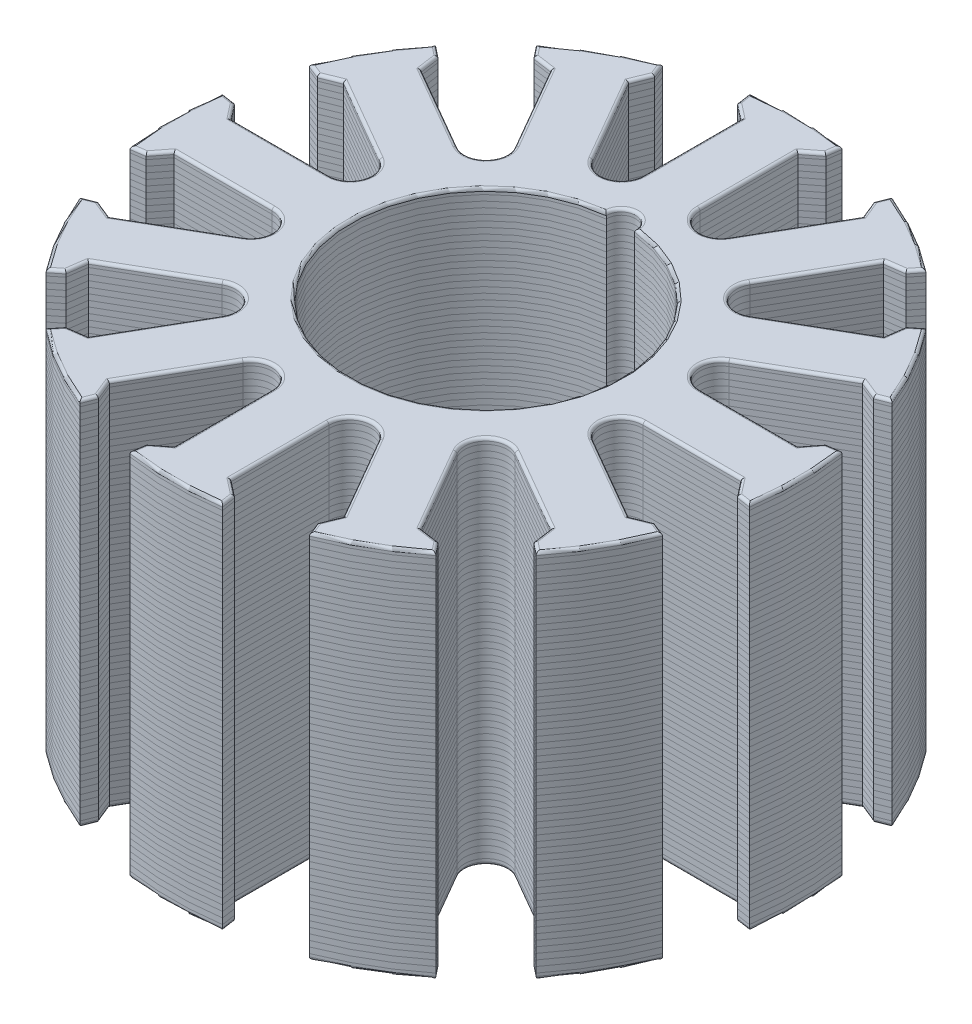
SolidWorks part; units mm, degrees
ref_plane "Plano frontal" through (0, 0, 0) normal (0, 0, 1) x (1, 0, 0)
ref_plane "Plano superior" through (0, 0, 0) normal (0, 1, 0) x (1, 0, 0)
ref_plane "Plano direito" through (0, 0, 0) normal (1, 0, 0) x (0, 0, -1)
sketch "Esboço1" plane through (0, 0, 0) normal (0, 0, 1) x (1, 0, 0)
  line L0 (0, 0) -> (0, 7.5364) construction
  line L2 (4.75, 0) -> (11, 0)
  line L3 (4.75, 0) -> (4.75, 0.2)
  line L4 (4.75, 0.2) -> (11, 0.2)
  line L5 (11, 0) -> (11, 0.2)
  dimension "D1" = 9.5
  dimension "D2" = 22
  dimension "D3" = 0.2
revolve "Revolução1" add sketch "Esboço1" angle 360 about L0
sketch "Esboço2" plane through (0, 0.2, 0) normal (0, 1, 0) x (1, 0, 0)
  line L0 (0, 0) -> (0, 11) construction
  line L1 (0, 0) -> (-1.6259, 10.8792) construction
  line L2 (0, 0) -> (-2.847, 10.6252) construction
  line L3 (-1, 10.9545) -> (-1, 6.5161) construction
  line L4 (0, 0) -> (-4.0315, 10.2346) construction
  line L5 (-4.6112, 9.9868) -> (-2.392, 6.1431) construction
  line L6 (-1, 6.5161) -> (-1, 9.9545)
  line L7 (-1, 9.9545) -> (-1.552, 10.3847)
  line L8 (-1.552, 10.3847) -> (-1.6259, 10.8792)
  line L9 (-2.392, 6.1431) -> (-4.1112, 9.1208)
  line L10 (-4.1112, 9.1208) -> (-3.8483, 9.7694)
  line L11 (-3.8483, 9.7694) -> (-4.0315, 10.2346)
  circle A0 centre (0, 0) radius 11 construction
  circle A1 centre (0, 0) radius 6 construction
  arc A2 (-2.392, 6.1431) -> (-1, 6.5161) centre (-1.746, 6.5161) ccw
  arc A3 (-4.0315, 10.2346) -> (-1.6259, 10.8792) centre (0, 0) cw
  dimension "D4" = 12
  dimension "D1" = 13
  dimension "D2" = 15
  dimension "D3" = 1
  dimension "D5" = 1
  dimension "D6" = 0.5
extrude "Corte-extrusão1" cut sketch "Esboço2" against normal blind 10
pattern_circular "PadrãoCircular1" count 12 over 360 about axis through (0, 0, 0) along (0, 1, 0) of "Corte-extrusão1"
pattern_linear "Padrão linear1" count 65 spacing 0.2 along (0, 1, 0)
sketch "Esboço3" plane through (0, 13, 0) normal (0, 1, 0) x (1, 0, 0)
  circle A0 centre (0, 4.75) radius 0.5
  circle A1 centre (0, 0) radius 4.75 construction
  dimension "D1" = 1
extrude "Corte-extrusão2" cut sketch "Esboço3" against normal through all
fillet "Filete1" radius 0.1 98 edges at (-6.692, 13, 8.413) (-6.1898, 13, 8.1691) (-4.9837, 13, 6.632) (-4.2426, 13, 4.2426) (-6.632, 13, 4.9837) (-8.1691, 13, 6.1898) (-8.413, 13, 6.692) (0, 13, -11) (-1.589, 13, 10.6319) (-1.276, 13, 10.1696) (-1, 13, 8.2353) (-1.5529, 13, 5.7956) (-3.2516, 13, 7.632) (-3.9797, 13, 9.4451) (-3.9399, 13, 10.002) (-10.002, 13, 3.9399) (-9.4451, 13, 3.9797) (-7.632, 13, 3.2516) (-5.7956, 13, 1.5529) (-8.2353, 13, 1) (-10.1696, 13, 1.276) (-10.6319, 13, 1.589) (-10.6319, 13, -1.589) (-10.1696, 13, -1.276) (-8.2353, 13, -1) (-5.7956, 13, -1.5529) (-7.632, 13, -3.2516) (-9.4451, 13, -3.9797) (-10.002, 13, -3.9399) (10.002, 13, -3.9399) (9.4451, 13, -3.9797) (7.632, 13, -3.2516) (5.7956, 13, -1.5529) (8.2353, 13, -1) (10.1696, 13, -1.276) (10.6319, 13, -1.589) (10.6319, 13, 1.589) (10.1696, 13, 1.276) (8.2353, 13, 1) (5.7956, 13, 1.5529) (7.632, 13, 3.2516) (9.4451, 13, 3.9797) (10.002, 13, 3.9399) (-3.9399, 13, -10.002) (-3.9797, 13, -9.4451) (3.9399, 13, 10.002) (3.9797, 13, 9.4451) (3.2516, 13, 7.632) (1.5529, 13, 5.7956) (1, 13, 8.2353) (1.276, 13, 10.1696) (-3.2516, 13, -7.632) (1.589, 13, 10.6319) (-1.5529, 13, -5.7956) (-1, 13, -8.2353) (-1.276, 13, -10.1696) (-1.589, 13, -10.6319) (8.413, 13, 6.692) (8.1691, 13, 6.1898) (6.632, 13, 4.9837) (4.2426, 13, 4.2426) (4.9837, 13, 6.632) (6.1898, 13, 8.1691) (6.692, 13, 8.413) (1.589, 13, -10.6319) (1.276, 13, -10.1696) (1, 13, -8.2353) (1.5529, 13, -5.7956) (3.2516, 13, -7.632) (3.9797, 13, -9.4451) (3.9399, 13, -10.002) (6.692, 13, -8.413) (6.1898, 13, -8.1691) (4.9837, 13, -6.632) (4.2426, 13, -4.2426) (6.632, 13, -4.9837) (8.1691, 13, -6.1898) (8.413, 13, -6.692) (-8.413, 13, -6.692) (-8.1691, 13, -6.1898) (-6.632, 13, -4.9837) (-4.2426, 13, -4.2426) (-4.9837, 13, -6.632) (-6.1898, 13, -8.1691) (-6.692, 13, -8.413) (0, 13, -5.25) (0, 13, 4.75) (5.5, 13, -9.5263) (9.5263, 13, -5.5) (11, 13, 0) (9.5263, 13, 5.5) (5.5, 13, 9.5263) (0, 13, 11) (-5.5, 13, 9.5263) (-9.5263, 13, 5.5) (-11, 13, 0) (-9.5263, 13, -5.5) (-5.5, 13, -9.5263)
fillet "Filete2" radius 0.1 98 edges at (-8.1691, 0, 6.1898) (-6.632, 0, 4.9837) (-4.2426, 0, 4.2426) (-4.9837, 0, 6.632) (-6.1898, 0, 8.1691) (-6.692, 0, 8.413) (-5.5, 0, 9.5263) (-3.9399, 0, 10.002) (-3.9797, 0, 9.4451) (-3.2516, 0, 7.632) (-1.5529, 0, 5.7956) (-1, 0, 8.2353) (-1.276, 0, 10.1696) (-1.589, 0, 10.6319) (0, 0, 11) (1.589, 0, 10.6319) (1.276, 0, 10.1696) (1, 0, 8.2353) (1.5529, 0, 5.7956) (3.2516, 0, 7.632) (3.9797, 0, 9.4451) (3.9399, 0, 10.002) (5.5, 0, 9.5263) (6.692, 0, 8.413) (6.1898, 0, 8.1691) (4.9837, 0, 6.632) (4.2426, 0, 4.2426) (6.632, 0, 4.9837) (8.1691, 0, 6.1898) (8.413, 0, 6.692) (9.5263, 0, 5.5) (10.002, 0, 3.9399) (9.4451, 0, 3.9797) (7.632, 0, 3.2516) (5.7956, 0, 1.5529) (8.2353, 0, 1) (10.1696, 0, 1.276) (10.6319, 0, 1.589) (11, 0, 0) (10.6319, 0, -1.589) (10.1696, 0, -1.276) (8.2353, 0, -1) (5.7956, 0, -1.5529) (7.632, 0, -3.2516) (9.4451, 0, -3.9797) (10.002, 0, -3.9399) (9.5263, 0, -5.5) (8.413, 0, -6.692) (8.1691, 0, -6.1898) (6.632, 0, -4.9837) (4.2426, 0, -4.2426) (4.9837, 0, -6.632) (6.1898, 0, -8.1691) (6.692, 0, -8.413) (5.5, 0, -9.5263) (3.9399, 0, -10.002) (3.9797, 0, -9.4451) (3.2516, 0, -7.632) (1.5529, 0, -5.7956) (1, 0, -8.2353) (1.276, 0, -10.1696) (1.589, 0, -10.6319) (0, 0, -11) (-1.589, 0, -10.6319) (-1.276, 0, -10.1696) (-1, 0, -8.2353) (-1.5529, 0, -5.7956) (-3.2516, 0, -7.632) (-3.9797, 0, -9.4451) (-3.9399, 0, -10.002) (-5.5, 0, -9.5263) (-6.692, 0, -8.413) (-6.1898, 0, -8.1691) (-4.9837, 0, -6.632) (-4.2426, 0, -4.2426) (-6.632, 0, -4.9837) (-8.1691, 0, -6.1898) (-8.413, 0, -6.692) (-9.5263, 0, -5.5) (-10.002, 0, -3.9399) (-9.4451, 0, -3.9797) (-7.632, 0, -3.2516) (-5.7956, 0, -1.5529) (-8.2353, 0, -1) (-10.1696, 0, -1.276) (-10.6319, 0, -1.589) (-11, 0, 0) (-10.6319, 0, 1.589) (-10.1696, 0, 1.276) (-8.2353, 0, 1) (-5.7956, 0, 1.5529) (-7.632, 0, 3.2516) (-9.4451, 0, 3.9797) (-10.002, 0, 3.9399) (-9.5263, 0, 5.5) (-8.413, 0, 6.692) (0, 0, 4.75) (0, 0, -5.25)
